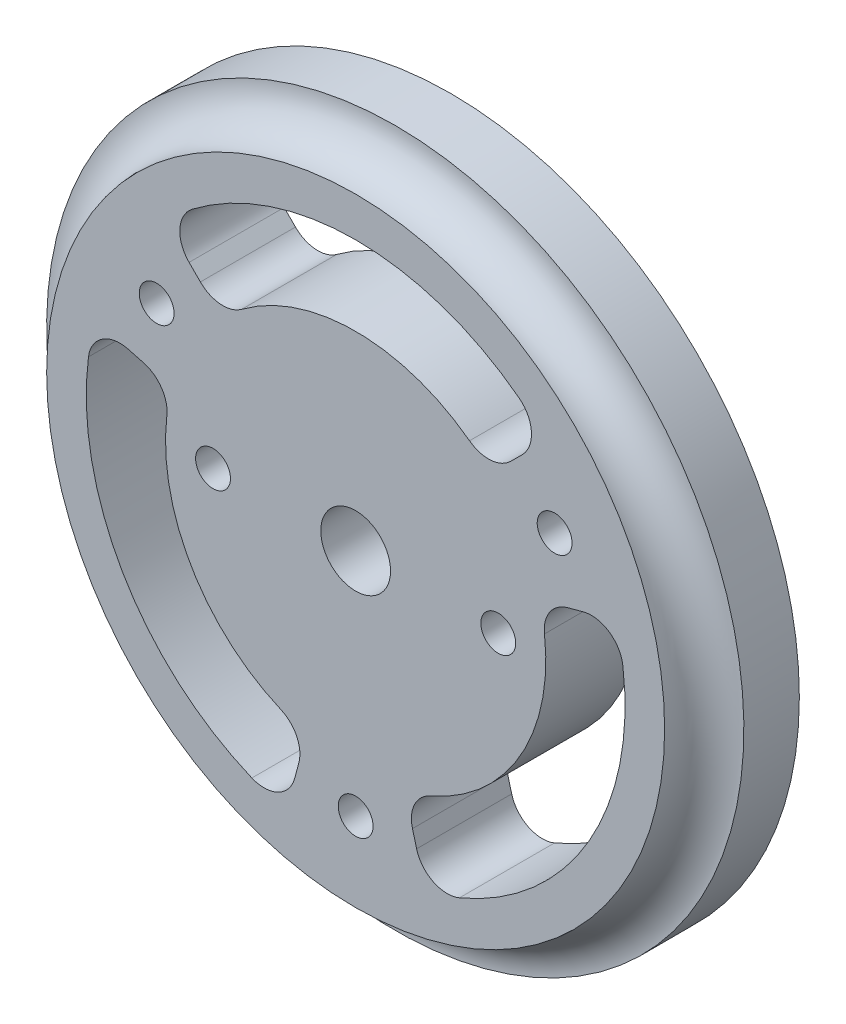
SolidWorks part; units mm, degrees
ref_plane "Face" through (0, 0, 0) normal (0, 0, 1) x (1, 0, 0)
ref_plane "Dessus" through (0, 0, 0) normal (0, 1, 0) x (1, 0, 0)
ref_plane "Droite" through (0, 0, 0) normal (1, 0, 0) x (0, 0, -1)
sketch "Esquisse1" plane through (0, 0, 0) normal (0, 0, 1) x (1, 0, 0)
  line L0 (0, -36.9559) -> (0, 56.4063) construction
  line L1 (28.4463, 0) -> (-48.8693, 0) construction
  line L2 (0, 0) -> (23.6546, 13.657) construction
  line L3 (0, 0) -> (18.3653, 18.3653) construction
  line L4 (9.798, 9.798) -> (10.5119, 10.5119)
  line L5 (-9.798, 9.798) -> (-10.5119, 10.5119)
  line L6 (13.3843, 3.5863) -> (14.3595, 3.8476)
  line L7 (3.5863, -13.3843) -> (3.8476, -14.3595)
  line L8 (-3.5863, -13.3843) -> (-3.8476, -14.3595)
  line L9 (-13.3843, 3.5863) -> (-14.3595, 3.8476)
  circle A0 centre (0, 0) radius 22
  circle A1 centre (0, 0) radius 12 construction
  circle A2 centre (0, 0) radius 2.2
  circle A3 centre (0, 0) radius 17 construction
  circle A4 centre (0, -14.5) radius 1.1
  circle A5 centre (-12.5574, 7.25) radius 1.1
  circle A6 centre (0, 0) radius 18.5 construction
  circle A7 centre (0, 0) radius 14.5 construction
  circle A8 centre (12.5574, 7.25) radius 1.1
  arc A9 (10.3107, 13.5163) -> (10.5119, 10.5119) centre (9.0977, 11.9261) cw
  arc A10 (7.1861, 9.6104) -> (9.798, 9.798) centre (8.3837, 11.2122) ccw
  arc A11 (7.1861, 9.6104) -> (-7.1861, 9.6104) centre (0, 0) ccw
  arc A12 (10.3107, 13.5163) -> (-10.3107, 13.5163) centre (0, 0) ccw
  arc A13 (-7.1861, 9.6104) -> (-9.798, 9.798) centre (-8.3837, 11.2122) cw
  arc A14 (-10.3107, 13.5163) -> (-10.5119, 10.5119) centre (-9.0977, 11.9261) ccw
  arc A15 (16.8608, 2.1712) -> (14.3595, 3.8476) centre (14.8772, 1.9158) ccw
  arc A16 (11.9159, 1.4181) -> (13.3843, 3.5863) centre (13.9019, 1.6545) cw
  arc A17 (4.7298, -11.0285) -> (11.9159, 1.4181) centre (0, 0) ccw
  arc A18 (6.5501, -15.6875) -> (16.8608, 2.1712) centre (0, 0) ccw
  arc A19 (6.5501, -15.6875) -> (3.8476, -14.3595) centre (5.7795, -13.8419) cw
  arc A20 (4.7298, -11.0285) -> (3.5863, -13.3843) centre (5.5182, -12.8666) ccw
  arc A21 (-6.5501, -15.6875) -> (-3.8476, -14.3595) centre (-5.7795, -13.8419) ccw
  arc A22 (-4.7298, -11.0285) -> (-3.5863, -13.3843) centre (-5.5182, -12.8666) cw
  arc A23 (-11.9159, 1.4181) -> (-4.7298, -11.0285) centre (0, 0) ccw
  arc A24 (-16.8608, 2.1712) -> (-6.5501, -15.6875) centre (0, 0) ccw
  arc A25 (-16.8608, 2.1712) -> (-14.3595, 3.8476) centre (-14.8772, 1.9158) cw
  arc A26 (-11.9159, 1.4181) -> (-13.3843, 3.5863) centre (-13.9019, 1.6545) ccw
  circle A27 centre (0, 0) radius 9 construction
  circle A28 centre (-9, 0) radius 1.1
  circle A29 centre (9, 0) radius 1.1
  point P22 (12.0208, 12.0208)
  point P28 (8.4853, 8.4853)
  point P31 (-8.4853, 8.4853)
  point P34 (-12.0208, 12.0208)
  dimension "D1" = 120
  dimension "D2" = 45
  dimension "D3" = 2
extrude "Extrusion1" add sketch "Esquisse1" along normal blind 6
sketch "Esquisse2" plane through (0, 0, 0) normal (1, 0, 0) x (0, 0, -1)
  line L0 (18.9227, 0) -> (-25.4902, 0) construction
  line L1 (-18.217, 22) -> (11.4432, 22) construction
  line L2 (0, 22.7739) -> (0, 8.7949) construction
  line L3 (0, -22) -> (0, 22) construction
  line L4 (-3.5, 22) -> (-6, 22)
  line L5 (-6, 23.6739) -> (-6, -21.1001) construction
  line L6 (-6, 22) -> (-6, 19.5)
  arc A0 (-6, 19.5) -> (-3.5, 22) centre (-6, 22) ccw
  dimension "D1" = 22
revolve "Enlèvement de matière-Révolution1" cut sketch "Esquisse2" angle 360 about L0
